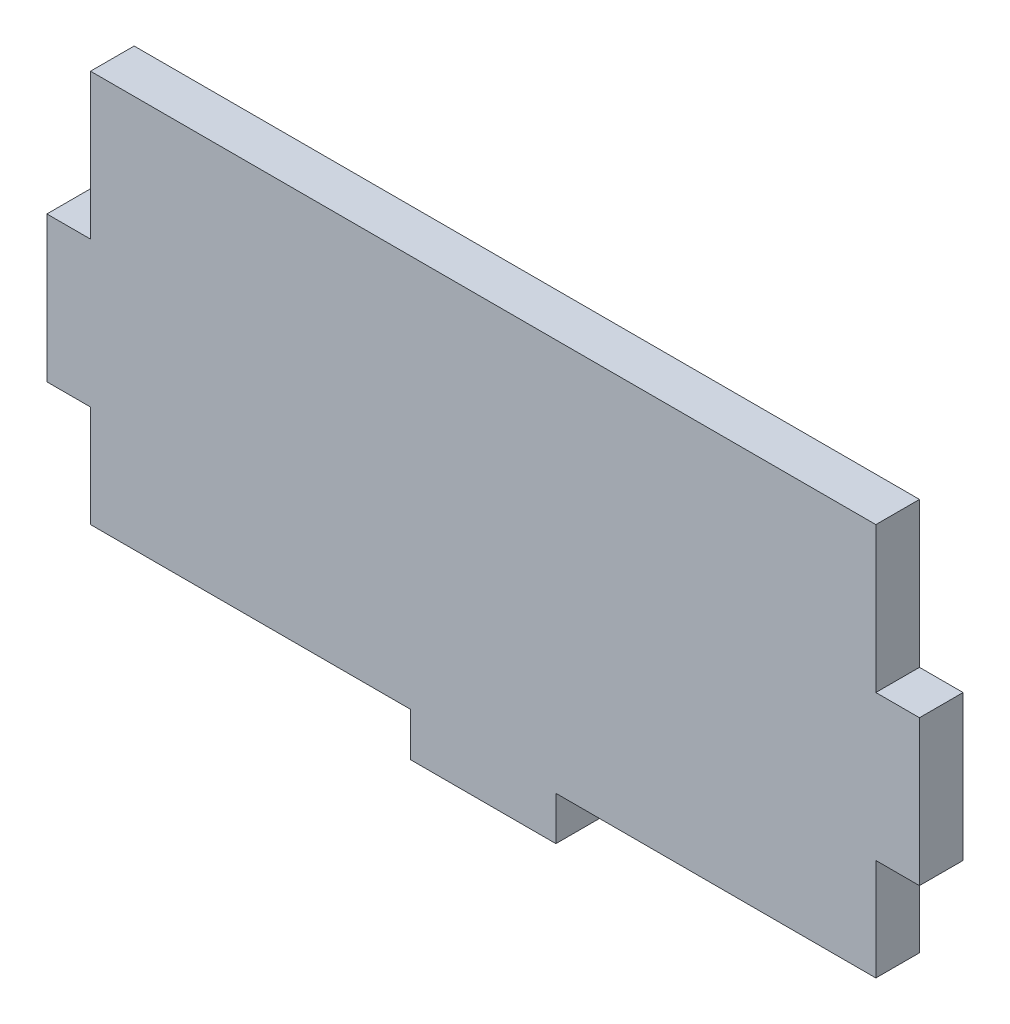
SolidWorks part; units mm, degrees
ref_plane "Front Plane" through (0, 0, 0) normal (0, 0, 1) x (1, 0, 0)
ref_plane "Top Plane" through (0, 0, 0) normal (0, 1, 0) x (1, 0, 0)
ref_plane "Right Plane" through (0, 0, 0) normal (1, 0, 0) x (0, 0, -1)
sketch "Sketch1" plane through (0, 0, 0) normal (0, 0, 1) x (1, 0, 0)
  line L6 (-89.3577, -39.4337) -> (-89.3577, -46.4337)
  line L7 (-89.3577, -19.4337) -> (-35.3577, -19.4337)
  line L15 (-92.3577, -29.4337) -> (-92.3577, -39.4337)
  line L16 (-67.3577, -49.4337) -> (-57.3577, -49.4337)
  line L21 (-32.3577, -29.4337) -> (-32.3577, -39.4337)
  line L22 (-89.3577, -19.4337) -> (-89.3577, -29.4337)
  line L23 (-35.3577, -19.4337) -> (-35.3577, -29.4337)
  line L24 (-57.3577, -46.4337) -> (-35.3577, -46.4337)
  line L25 (-92.3577, -29.4337) -> (-89.3577, -29.4337)
  line L26 (-92.3577, -39.4337) -> (-89.3577, -39.4337)
  line L27 (-32.3577, -29.4337) -> (-35.3577, -29.4337)
  line L28 (-32.3577, -39.4337) -> (-35.3577, -39.4337)
  line L29 (-89.3577, -46.4337) -> (-67.3577, -46.4337)
  line L30 (-35.3577, -39.4337) -> (-35.3577, -46.4337)
  line L31 (-57.3577, -46.4337) -> (-57.3577, -49.4337)
  line L32 (-67.3577, -46.4337) -> (-67.3577, -49.4337)
extrude "Boss-Extrude1" add sketch "Sketch1" along normal blind 3
